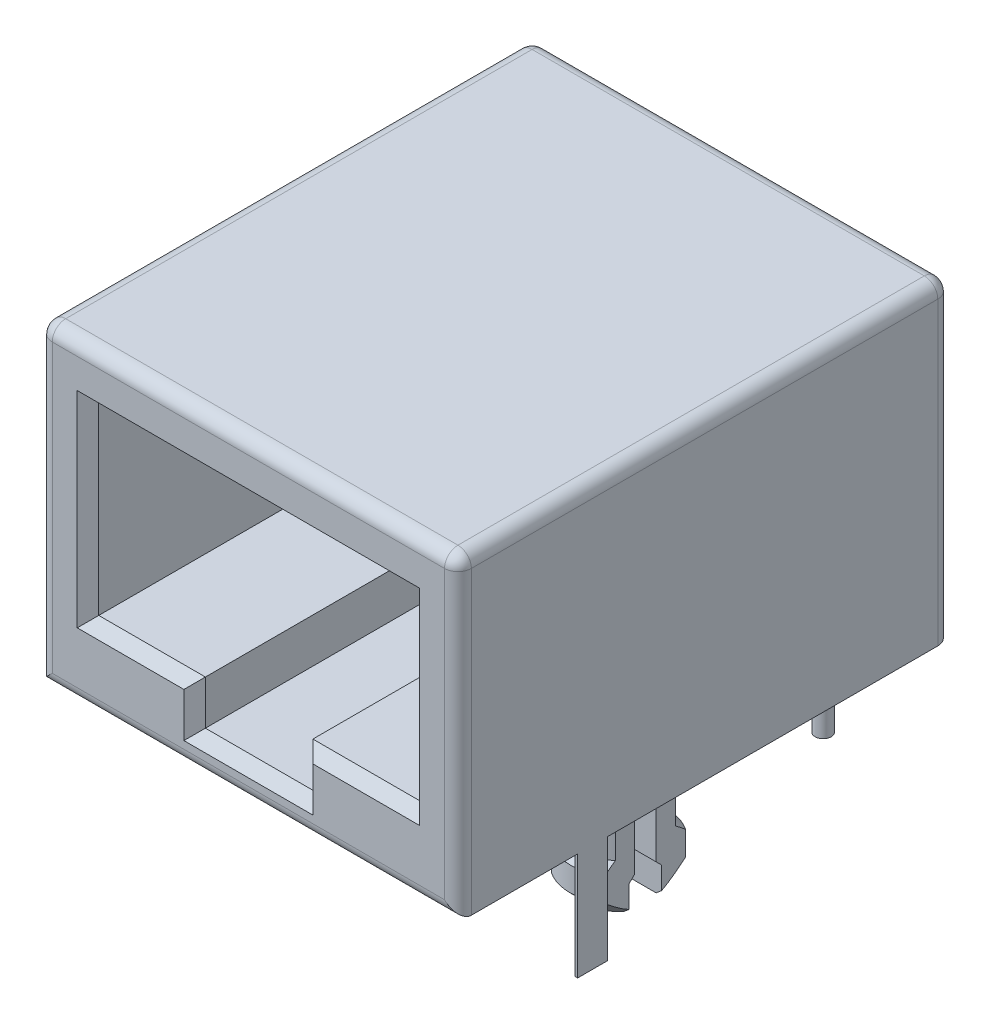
SolidWorks part; units mm, degrees
ref_plane "Front" through (0, 0, 0) normal (0, 0, 1) x (1, 0, 0)
ref_plane "Top" through (0, 0, 0) normal (0, 1, 0) x (1, 0, 0)
ref_plane "Right" through (0, 0, 0) normal (1, 0, 0) x (0, 0, -1)
sketch "Эскиз1" plane through (0, 0, 0) normal (0, 1, 0) x (1, 0, 0)
  line L1 (-7.8, 0) -> (7.8, 0)
  line L2 (-7.8, 0) -> (-7.8, 18.36)
  line L3 (-7.8, 18.36) -> (7.8, 18.36)
  line L4 (7.8, 0) -> (7.8, 18.36)
  dimension "D1" = 18.36
  dimension "D2" = 15.6
extrude "Вытянуть1" add sketch "Эскиз1" along normal blind 11.68
sketch "Эскиз2" plane through (0, 0, 0) normal (0, 0, 1) x (1, 0, 0)
  line L0 (2, 2.83) -> (5.97, 2.83)
  line L1 (-5.97, 9.68) -> (5.97, 9.68)
  line L2 (-5.97, 9.68) -> (-5.97, 2.83)
  line L3 (-5.97, 2.83) -> (-2, 2.83)
  line L4 (5.97, 9.68) -> (5.97, 2.83)
  line L5 (0, 9.68) -> (0, 0) construction
  line L6 (-2, 2.83) -> (-2, 1.18)
  line L7 (-2, 1.18) -> (2, 1.18)
  line L8 (2, 2.83) -> (2, 1.18)
  line L10 (-7.8, 11.68) -> (7.8, 11.68) construction
  dimension "D1" = 11.94
  dimension "D2" = 6.85
  dimension "D3" = 8.5
  dimension "D4" = 2
  dimension "D5" = 4
extrude "Вырез-Вытянуть1" cut sketch "Эскиз2" against normal blind 12
sketch "Эскиз3" plane through (0, 0, 0) normal (0, -1, 0) x (1, 0, 0)
  line L0 (0, 0) -> (0, -18.36) construction
  line L1 (7.8, -18.36) -> (-7.8, -18.36) construction
  line L2 (-7.7, -5.565) -> (-7.7, -4.455)
  line L3 (7.8, -5.565) -> (7.7, -5.565)
  line L4 (7.8, -5.565) -> (7.8, -4.455)
  line L5 (7.8, -4.455) -> (7.7, -4.455)
  line L6 (7.7, -5.565) -> (7.7, -4.455)
  line L7 (-7.8, -4.455) -> (-7.7, -4.455)
  line L8 (-7.8, -5.565) -> (-7.8, -4.455)
  line L9 (-7.8, -5.565) -> (-7.7, -5.565)
  line L10 (7.75, -4.455) -> (7.75, -5.565) construction
  line L11 (-7.75, -4.455) -> (-7.75, -5.565) construction
  line L12 (7.8, 0) -> (7.8, -18.36) construction
  line L13 (7.8, -5.01) -> (7.7, -5.01) construction
  line L14 (-7.8, 0) -> (7.8, 0) construction
  line L15 (4.445, -16.95) -> (1.905, -16.95) construction
  line L16 (4.445, -16.95) -> (3.175, -14.41) construction
  line L17 (6.715, -9.5567) -> (6.715, -6.5633)
  line L18 (4.715, -9.5567) -> (4.715, -6.5633)
  line L19 (-6.715, -9.5567) -> (-6.715, -6.5633)
  line L21 (-4.715, -9.5567) -> (-4.715, -6.5633)
  circle A0 centre (4.445, -16.95) radius 0.3
  arc A1 (4.715, -9.5567) -> (6.715, -9.5567) centre (5.715, -8.06) ccw
  circle A2 centre (1.905, -16.95) radius 0.3
  circle A3 centre (-0.635, -16.95) radius 0.3
  arc A4 (-6.715, -6.5633) -> (-4.715, -6.5633) centre (-5.715, -8.06) cw
  circle A5 centre (-3.175, -16.95) radius 0.3
  circle A6 centre (3.175, -14.41) radius 0.3
  circle A7 centre (0.635, -14.41) radius 0.3
  circle A8 centre (-1.905, -14.41) radius 0.3
  circle A9 centre (-4.445, -14.41) radius 0.3
  arc A10 (-4.715, -9.5567) -> (-6.715, -9.5567) centre (-5.715, -8.06) cw
  arc A11 (6.715, -6.5633) -> (4.715, -6.5633) centre (5.715, -8.06) ccw
  point P29 (3.175, -16.95)
  dimension "D1" = 11.43
  dimension "D2" = 15.5
  dimension "D4" = 3.6
  dimension "D7" = 2.54
  dimension "D8" = 2.54
  dimension "D9" = 6.35
  dimension "D10" = 4.445
  dimension "D11" = 0.6
  dimension "D3" = 3.05
  dimension "D5" = 8.06
  dimension "D6" = 1.11
  dimension "D12" = 2
extrude "Вытянуть2" add sketch "Эскиз3" along normal blind 4
ref_plane "Плоскость2" through (5.715, 0, 0) normal (1, 0, 0) x (0, 0, -1)
sketch "Эскиз4" plane through (5.715, 0, -3.0373) normal (1, 0, 0) x (0, 0, -1)
  line L0 (6.5227, 0) -> (6.5227, -2)
  line L3 (2.5277, 0) -> (15.3227, 0) construction
  line L4 (6.5227, -2) -> (6.8227, -2.3)
  line L5 (6.8227, -4) -> (6.8227, 0) construction
  line L7 (6.8227, -2.3) -> (6.8227, -3.2)
  line L8 (6.8227, -3.2) -> (6.0227, -4)
  line L9 (6.5194, -4) -> (3.526, -4) construction
  line L18 (6.0227, -4.4) -> (7.0227, -4.4)
  line L19 (7.0227, -4.4) -> (7.0227, 0)
  line L20 (7.0227, 0) -> (6.5227, 0)
  line L21 (5.0227, 0) -> (5.0227, -4) construction
  line L22 (6.5194, 0) -> (3.526, 0) construction
  line L23 (6.0227, -4) -> (6.0227, -4.4)
  dimension "D1" = 3
  dimension "D2" = 4
  dimension "D3" = 2
  dimension "D4" = 45
  dimension "D5" = 2
  dimension "D6" = 4.4
revolve "Вырез-Повернуть1" cut sketch "Эскиз4" angle 360 about L21
ref_plane "Плоскость3" through (-5.715, 0, 0) normal (1, 0, 0) x (0, 0, -1)
sketch "Эскиз5" plane through (-5.715, 0, 0) normal (1, 0, 0) x (0, 0, -1)
  line L0 (8.06, -4) -> (8.06, -2.4569) construction
  line L1 (9.5567, -4) -> (6.5633, -4) construction
  line L8 (9.06, -4.4) -> (10.06, -4.4)
  line L9 (10.06, -4.4) -> (10.06, 0)
  line L10 (10.06, 0) -> (9.56, 0)
  line L11 (9.56, 0) -> (9.56, -2)
  line L12 (9.56, -2) -> (9.86, -2.3)
  line L13 (9.86, -2.3) -> (9.86, -3.2)
  line L14 (9.86, -3.2) -> (9.06, -4)
  line L15 (9.06, -4) -> (9.06, -4.4)
  line L16 (9.06, -4.4) -> (10.06, -4.4)
  line L17 (10.06, -4.4) -> (10.06, 0)
  line L18 (10.06, 0) -> (9.56, 0)
  line L19 (9.56, 0) -> (9.56, -2)
  line L20 (9.56, -2) -> (9.86, -2.3)
  line L21 (9.86, -2.3) -> (9.86, -3.2)
  line L22 (9.86, -3.2) -> (9.06, -4)
  line L23 (9.06, -4) -> (9.06, -4.4)
  dimension "D1" = 0
revolve "Вырез-Повернуть2" cut sketch "Эскиз5" angle 360 about L0
sketch "Эскиз6" plane through (0, 0, 0) normal (1, 0, 0) x (0, 0, -1)
  line L0 (7.46, -4) -> (7.46, -3)
  line L1 (7.46, -3) -> (7.66, -2.8)
  line L2 (7.66, -2.8) -> (7.66, -1)
  line L3 (8.06, -0.6) -> (8.06, -4) construction
  line L4 (7.46, -4) -> (8.66, -4)
  line L5 (8.46, -2.8) -> (8.46, -1)
  line L6 (8.66, -3) -> (8.46, -2.8)
  line L7 (8.66, -4) -> (8.66, -3)
  arc A0 (7.66, -1) -> (8.46, -1) centre (8.06, -1) cw
  dimension "D1" = 3.4
  dimension "D2" = 0.8
  dimension "D3" = 1.2
  dimension "D4" = 45
  dimension "D5" = 1
extrude "Вырез-Вытянуть2" cut sketch "Эскиз6" against normal through all and the other way through all
ref_plane "Плоскость4" through (-4.445, 0, 0) normal (1, 0, 0) x (0, 0, -1)
sketch "Эскиз7" plane through (-4.445, 0, 0) normal (1, 0, 0) x (0, 0, -1)
  line L0 (3.448, 8.9616) -> (8.48, 6.496)
  line L1 (12, 9.68) -> (0, 9.68) construction
  line L2 (12, 9.68) -> (12, 2.83) construction
  line L3 (0, 11.68) -> (0, 0) construction
  line L4 (0, 11.68) -> (18.36, 11.68) construction
  arc A0 (3.448, 8.9616) -> (3, 9.68) centre (3.8, 9.68) cw
  arc A1 (8.48, 6.496) -> (12, 5.68) centre (12, 13.68) ccw
  dimension "D4" = 0.8
  dimension "D3" = 8
  dimension "D1" = 3
  dimension "D2" = 6
extrude "Вытянуть-Тонкостенный1" add sketch "Эскиз7" along normal mid plane 0.6 thin
pattern_linear "Линейный массив1" count 8 spacing 1.27 along (1, 0, 0) of "Вытянуть-Тонкостенный1"
fillet "Скругление1" radius 0.5 9 edges at (0, 11.68, -18.36) (7.8, 11.68, -9.18) (0, 11.68, 0) (-7.8, 11.68, -9.18) (-7.8, 5.84, -18.36) (7.8, 5.84, -18.36) (-7.8, 5.84, 0) (0, 0, 0) (7.8, 5.84, 0)
chamfer "Фаска1" distance 0.4 angle 45 8 edges at (0, 1.18, 0) (-2, 2.005, 0) (-3.985, 2.83, 0) (2, 2.005, 0) (3.985, 2.83, 0) (5.97, 6.255, 0) (0, 9.68, 0) (-5.97, 6.255, 0)
